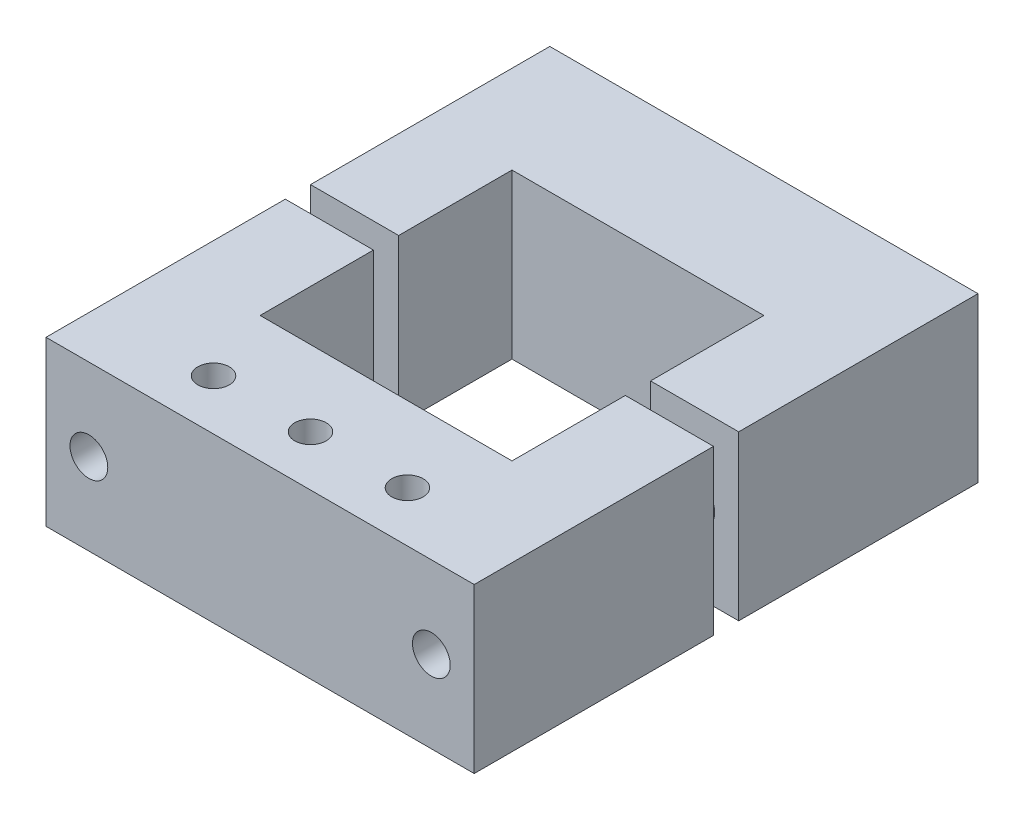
SolidWorks part; units mm, degrees
ref_plane "Front Plane" through (0, 0, 0) normal (0, 0, 1) x (1, 0, 0)
ref_plane "Top Plane" through (0, 0, 0) normal (0, 1, 0) x (1, 0, 0)
ref_plane "Right Plane" through (0, 0, 0) normal (1, 0, 0) x (0, 0, -1)
sketch "Sketch1" plane through (0, 0, 0) normal (0, 0, 1) x (1, 0, 0)
  line L0 (210.3422, -136.0585) -> (210.3422, -130.0585) construction
  line L1 (244.3422, -136.0585) -> (244.3422, -149.0585)
  line L2 (210.3422, -136.0585) -> (244.3422, -136.0585)
  line L3 (244.3422, -149.0585) -> (210.3422, -149.0585)
  line L4 (210.3422, -149.0585) -> (210.3422, -136.0585)
  line L5 (210.3422, -149.0585) -> (210.3422, -136.0585) construction
  line L6 (217.1498, -136.0585) -> (210.3422, -149.0585) construction
  line L7 (227.3422, -149.0585) -> (227.3422, -136.0585) construction
  circle A0 centre (213.746, -142.5585) radius 1.5
  circle A1 centre (240.9383, -142.5585) radius 1.5
extrude "Boss-Extrude1" add sketch "Sketch1" along normal blind 10 and the other way blind 30
sketch "Sketch2" plane through (0, -136.0585, 0) normal (0, 1, 0) x (-1, 0, 0)
  line L0 (-237.3422, -20) -> (-217.3422, -20)
  line L1 (-217.3422, -20) -> (-217.3422, -11)
  line L2 (-217.3422, 0) -> (-237.3422, 0)
  line L3 (-237.3422, 0) -> (-237.3422, -9)
  line L4 (-244.3422, -9) -> (-237.3422, -9)
  line L5 (-244.3422, -30) -> (-244.3422, 10) construction
  line L6 (-217.3422, -9) -> (-217.3422, 0)
  line L7 (-237.3422, -11) -> (-244.3422, -11)
  line L8 (-244.3422, -11) -> (-244.3422, -9)
  line L9 (-227.3422, 0) -> (-227.3422, -20) construction
  line L10 (-217.3422, -11) -> (-210.3422, -11)
  line L11 (-210.3422, -9) -> (-217.3422, -9)
  line L12 (-210.3422, -11) -> (-210.3422, -9)
  line L13 (-237.3422, -11) -> (-237.3422, -20)
  circle A0 centre (-235.0401, 6) radius 1.25
  circle A1 centre (-227.3422, 6) radius 1.25
  circle A2 centre (-219.6442, 6) radius 1.25
extrude "Cut-Extrude1" cut sketch "Sketch2" against normal blind 20
